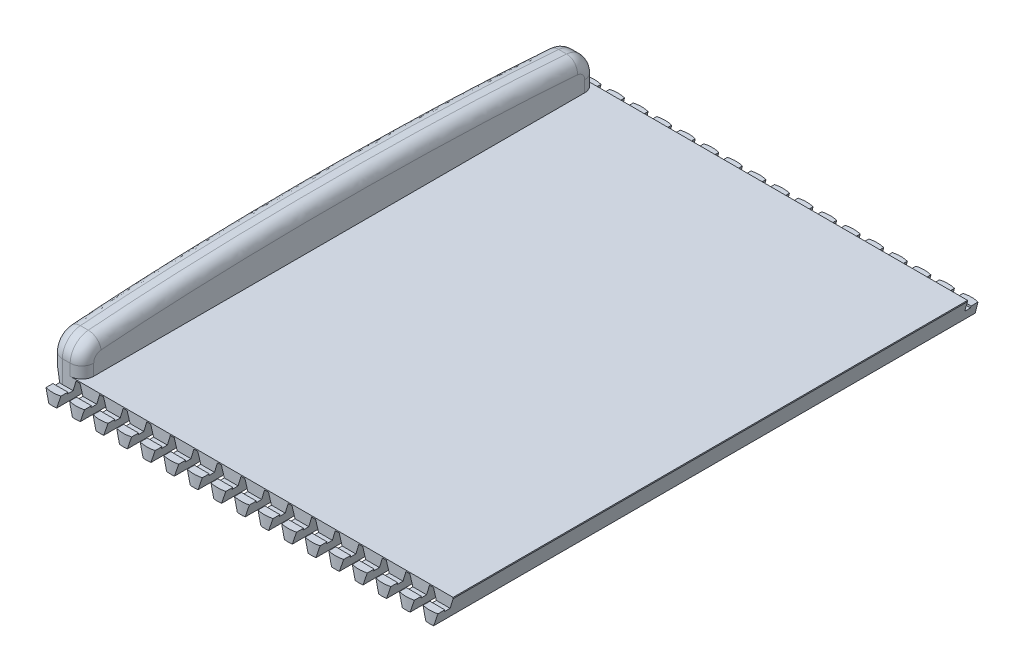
SolidWorks part; units mm, degrees
ref_plane "Alzado" through (0, 0, 0) normal (0, 0, 1) x (1, 0, 0)
ref_plane "Planta" through (0, 0, 0) normal (0, 1, 0) x (1, 0, 0)
ref_plane "Vista lateral" through (0, 0, 0) normal (1, 0, 0) x (0, 0, -1)
sketch "Croquis1" plane through (0, 0, 0) normal (0, 0, 1) x (1, 0, 0)
  line L0 (-2.5, 0) -> (2.5, 0)
  line L1 (2.5, 0) -> (1, -5)
  line L2 (1, -5) -> (-1, -5)
  line L3 (-1, -5) -> (-2.5, 0)
  point P3 (0, -5)
  dimension "D1" = 5
  dimension "D2" = 5
  dimension "D3" = 2
extrude "Saliente-Extruir1" add sketch "Croquis1" along normal mid plane 138
sketch "Croquis2" plane through (0, 0, 0) normal (1, 0, 0) x (0, 0, -1)
  line L0 (-69, 0) -> (69, 0) construction
  line L1 (-65.5, 0) -> (-65.5, -2.5)
  line L2 (-65.5, -2.5) -> (-67, -2.5)
  line L4 (-69, -2) -> (-69, 0)
  line L5 (-69, 0) -> (-65.5, 0)
  line L6 (-67, -2.5) -> (-67, -2)
  line L7 (-67, -2) -> (-69, -2)
  dimension "D1" = 3.5
  dimension "D2" = 2
  dimension "D3" = 0.5
  dimension "D4" = 2
extrude "Cortar-Extruir1" cut sketch "Croquis2" against normal through all both and the other way through all
sketch "Croquis6" plane through (0, -2, 0) normal (0, 1, 0) x (1, 0, 0)
  line L0 (1.9, -69) -> (-1.9, -69) construction
  line L1 (-1.9, -69) -> (-1.9, -67) construction
  line L2 (1.9, -67) -> (1.9, -69) construction
  line L3 (-1.9, -70) -> (-1.9, -68.7553)
  line L4 (1.9, -68.7553) -> (1.9, -70)
  line L5 (-1.9, -70) -> (1.9, -70)
  arc A0 (-1.9, -68.7553) -> (1.9, -68.7553) centre (0, -61.5) ccw
  dimension "D1" = 15
  dimension "D2" = 1
extrude "Cortar-Extruir3" cut sketch "Croquis6" against normal up to next
mirror "Simetría1" about plane through (0, 0, 0) normal (0, 0, 1) of "Cortar-Extruir3", "Cortar-Extruir1"
pattern_linear "MatrizL1" count 17 spacing 6 along (1, 0, 0)
sketch "Croquis3" plane through (0, 0, 65.5) normal (0, 0, 1) x (1, 0, 0)
  line L1 (-4, 0) -> (98.5, 0)
  line L2 (-4, 0) -> (-4, 0.3)
  line L3 (-4, 0.3) -> (98.5, 0.3)
  line L4 (98.5, 0) -> (98.5, 0.3)
  dimension "D1" = 0.3
  dimension "D2" = 1.5
extrude "Saliente-Extruir2" add sketch "Croquis3" against normal up to surface (131 mm away)
sketch "Croquis4" plane through (0, 0.3, 0) normal (0, 1, 0) x (1, 0, 0)
  line L1 (-4, 65.5) -> (4, 65.5)
  line L2 (-4, 65.5) -> (-4, -65.5)
  line L3 (-4, -65.5) -> (4, -65.5)
  line L4 (4, 65.5) -> (4, -65.5)
  line L6 (98.5, -65.5) -> (-4, -65.5) construction
  point P4 (0, 65.5)
extrude "Saliente-Extruir3" add sketch "Croquis4" along normal blind 10
sketch "Croquis5" plane through (-4, 0, 0) normal (-1, 0, 0) x (0, 0, 1)
  line L0 (-65.5, 10.3) -> (65.5, 10.3) construction
  ellipse E0 centre (0, 0) end of major axis (-100, 0) minor radius 10.3
  dimension "D1" = 200
extrude "Cortar-Extruir2" cut sketch "Croquis5" against normal through all both and the other way through all flip side to cut
fillet "Redondeo1" radius 5 2 edges at (0, 7.783, 65.5) (0, 7.783, -65.5)
fillet "Redondeo2" radius 3 10 edges at (4, 6.579, 64.1722) (4, 6.579, -64.1722) (-4, 1.5928, -65.5) (-4, 6.579, -64.1722) (-4, 1.5928, 65.5) (-4, 6.579, 64.1722) (4, 10.3, 0) (-4, 10.3, 0)
ref_plane "Plano1" through (0, -10, 0) normal (0, 1, 0) x (1, 0, 0)
sketch "Croquis7" plane through (0, -10, 0) normal (0, -1, 0) x (1, 0, 0)
  line L1 (-2.5, 65.5) -> (116.5, 65.5)
  line L2 (-2.5, 65.5) -> (-2.5, -65.5)
  line L3 (-2.5, -65.5) -> (116.5, -65.5)
  line L4 (116.5, 65.5) -> (116.5, -65.5)
extrude "Saliente-Extruir5" add sketch "Croquis7" against normal up to next separate body
sketch "Croquis8" plane through (0, -10, 0) normal (0, -1, 0) x (1, 0, 0)
  line L1 (-2.5, 65.5) -> (116.5, 65.5)
  line L2 (-2.5, 65.5) -> (-2.5, 67)
  line L3 (-2.5, 67) -> (116.5, 67)
  line L4 (116.5, 65.5) -> (116.5, 67)
  dimension "D1" = 1.5
extrude "Saliente-Extruir6" add sketch "Croquis8" against normal up to surface (10 mm away)
